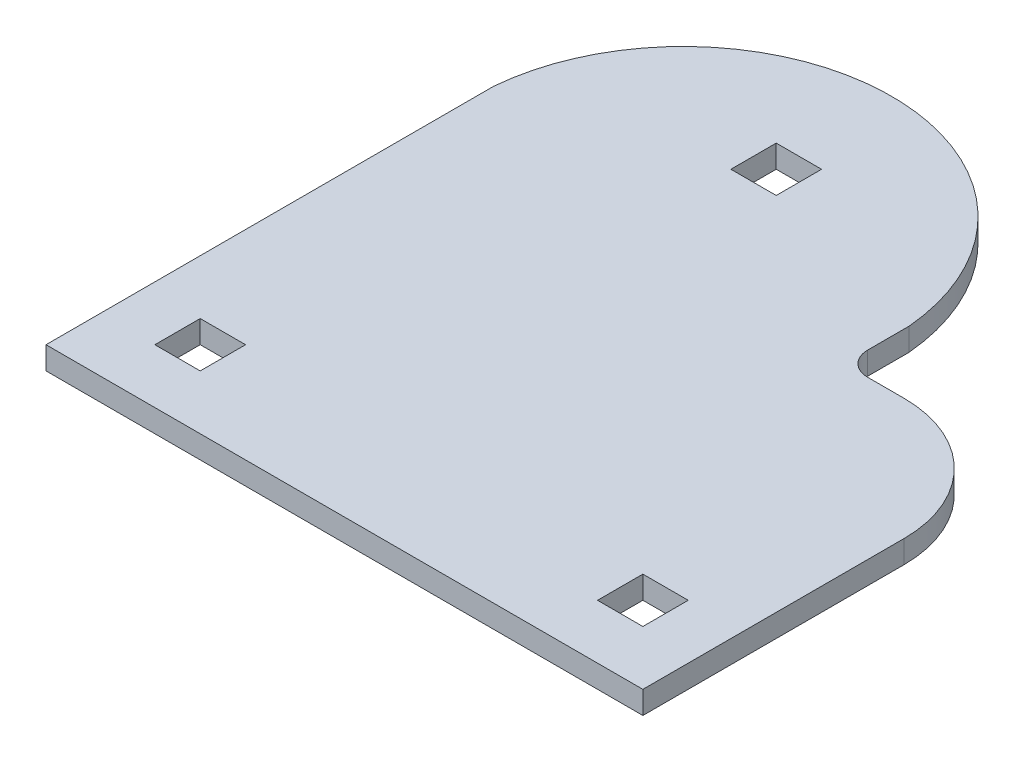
SolidWorks part; units mm, degrees
ref_plane "Front Plane" through (0, 0, 0) normal (0, 0, 1) x (1, 0, 0)
ref_plane "Top Plane" through (0, 0, 0) normal (0, 1, 0) x (1, 0, 0)
ref_plane "Right Plane" through (0, 0, 0) normal (1, 0, 0) x (0, 0, -1)
sketch "circuit outline" plane through (0, 0, 0) normal (0, 1, 0) x (1, 0, 0)
  line L0 (-69.85, 0) -> (-69.85, 15.875)
  line L1 (0, -31.75) -> (-69.85, -31.75)
  line L2 (0, -31.75) -> (0, 0)
  line L3 (0, 0) -> (-17.78, 0)
  line L4 (-69.85, -31.75) -> (-69.85, 0)
  line L5 (-25.4, 15.875) -> (-25.4, 7.62)
  arc A0 (-25.4, 15.875) -> (-69.85, 15.875) centre (-47.625, 15.875) ccw
  arc A1 (-17.78, 0) -> (-25.4, 7.62) centre (-17.78, 7.62) cw
  point P6 (-47.625, 38.1)
  dimension "D3" = 44.45
  dimension "D5" = 7.62
  dimension "D1" = 38.1
  dimension "D2" = 69.85
  dimension "D4" = 31.75
sketch "Sketch2" plane through (0, 0, 0) normal (0, 1, 0) x (1, 0, 0)
  line L0 (0, -31.75) -> (0, 0) construction
  line L1 (0, -31.75) -> (0, 0) construction
  line L2 (0, -31.75) -> (-69.85, -31.75) construction
  line L3 (-69.85, -31.75) -> (-69.85, 0) construction
  line L4 (-69.85, 0) -> (-69.85, 15.875) construction
  line L5 (-25.4, 15.875) -> (-25.4, 7.62) construction
  line L6 (0, 0) -> (-17.78, 0) construction
  line L7 (0, -31.75) -> (-69.85, -31.75) construction
  line L8 (-69.85, -31.75) -> (-69.85, 0) construction
  line L9 (-69.85, 0) -> (-69.85, 15.875) construction
  line L10 (-25.4, 15.875) -> (-25.4, 7.62) construction
  line L11 (0, 0) -> (-17.78, 0) construction
  line L12 (5.08, -36.83) -> (5.08, -10.16)
  line L13 (-10.16, 5.08) -> (-15.24, 5.08)
  line L14 (-20.32, 15.875) -> (-20.32, 10.16)
  line L15 (-74.93, 0) -> (-74.93, 15.875)
  line L16 (-74.93, -36.83) -> (-74.93, 0)
  line L17 (5.08, -36.83) -> (-74.93, -36.83)
  line L19 (-76.708, -38.608) -> (6.858, -38.608)
  line L20 (-76.708, -38.608) -> (-76.708, -44.9372)
  line L21 (-18.542, 15.9538) -> (-18.542, 10.16)
  line L22 (-76.708, 0) -> (-76.708, 15.9538)
  line L23 (-76.708, -38.608) -> (-76.708, 0)
  line L24 (6.858, -38.608) -> (-76.708, -38.608)
  line L25 (6.858, -38.608) -> (6.858, -10.16)
  line L26 (-10.16, 6.858) -> (-15.24, 6.858)
  line L27 (-22.098, 14.7785) -> (-22.098, 9.0635)
  line L28 (-73.152, -1.0965) -> (-73.152, 14.7785)
  line L29 (-73.152, -36.1485) -> (-73.152, -1.0965)
  line L30 (3.302, -36.1485) -> (-73.152, -36.1485)
  line L31 (3.302, -36.1485) -> (3.302, -11.2565)
  line L32 (-10.16, 2.2055) -> (-15.24, 2.2055)
  line L33 (-76.708, -44.9372) -> (6.858, -44.9372)
  line L34 (6.858, -38.608) -> (6.858, -44.9372)
  line L35 (-76.708, -44.9372) -> (6.858, -44.9372)
  line L36 (-76.708, -44.9372) -> (-76.708, -46.7152)
  line L37 (-76.708, -46.7152) -> (6.858, -46.7152)
  line L38 (6.858, -44.9372) -> (6.858, -46.7152)
  arc A0 (-25.4, 15.875) -> (-69.85, 15.875) centre (-47.625, 15.875) ccw construction
  arc A1 (-25.4, 7.62) -> (-17.78, 0) centre (-17.78, 7.62) ccw construction
  arc A2 (-25.4, 15.875) -> (-69.85, 15.875) centre (-47.625, 15.875) ccw construction
  arc A3 (-25.4, 7.62) -> (-17.78, 0) centre (-17.78, 7.62) ccw construction
  arc A5 (-20.32, 15.875) -> (-74.93, 15.875) centre (-47.625, 13.4126) ccw
  arc A6 (5.08, -10.16) -> (-10.16, 5.08) centre (-10.16, -10.16) ccw
  arc A8 (-15.24, 5.08) -> (-20.32, 10.16) centre (-15.24, 10.16) cw
  arc A9 (-15.24, 6.858) -> (-18.542, 10.16) centre (-15.24, 10.16) cw
  arc A10 (-18.542, 15.9538) -> (-76.708, 15.9538) centre (-47.625, 13.4126) ccw
  arc A11 (6.858, -10.16) -> (-10.16, 6.858) centre (-10.16, -10.16) ccw
  arc A12 (-15.24, 2.2055) -> (-22.098, 9.0635) centre (-15.24, 9.0635) cw
  arc A13 (-22.098, 14.7785) -> (-73.152, 14.7785) centre (-47.625, 13.335) ccw
  arc A14 (3.302, -11.2565) -> (-10.16, 2.2055) centre (-10.16, -11.2565) ccw
  dimension "D2" = 15.24
  dimension "D3" = 5.08
  dimension "D1" = 6.3292
  dimension "D5" = 2.54
  dimension "D6" = 1.778
  dimension "D4" = 1.778
extrude "lid" add sketch "Sketch2" along normal blind 3.175 contours L34 L19 L20 L33 | L38 L33 L36 L37 | L22 A10 L21 A9 L26 A11 L25 L24 L23
sketch "Sketch3" plane through (0, 3.175, 0) normal (0, 1, 0) x (1, 0, 0)
  line L0 (-34.925, -46.7152) -> (-34.925, -57.3007) construction
  line L1 (-76.708, -46.7152) -> (6.858, -46.7152) construction
  line L2 (-76.708, 15.9538) -> (-76.708, -46.7152) construction
  line L3 (-69.088, -39.0952) -> (-62.738, -39.0952)
  line L4 (-69.088, -39.0952) -> (-69.088, -32.7452)
  line L5 (-69.088, -32.7452) -> (-62.738, -32.7452)
  line L6 (-62.738, -39.0952) -> (-62.738, -32.7452)
  line L7 (-69.088, -39.0952) -> (-62.738, -32.7452) construction
  line L8 (-69.088, -32.7452) -> (-62.738, -39.0952) construction
  line L9 (-0.762, -32.7452) -> (-7.112, -39.0952) construction
  line L10 (-0.762, -39.0952) -> (-7.112, -32.7452) construction
  line L11 (-7.112, -39.0952) -> (-7.112, -32.7452)
  line L12 (-0.762, -32.7452) -> (-7.112, -32.7452)
  line L13 (-0.762, -39.0952) -> (-0.762, -32.7452)
  line L14 (-0.762, -39.0952) -> (-7.112, -39.0952)
  line L16 (-50.038, 28.8498) -> (-43.688, 28.8498)
  line L17 (-50.038, 28.8498) -> (-50.038, 22.4998)
  line L18 (-50.038, 22.4998) -> (-43.688, 22.4998)
  line L19 (-43.688, 28.8498) -> (-43.688, 22.4998)
  line L20 (-50.038, 28.8498) -> (-43.688, 22.4998) construction
  line L21 (-50.038, 22.4998) -> (-43.688, 28.8498) construction
  point P4 (-65.913, -35.9202)
  point P15 (-3.937, -35.9202)
  point P16 (-46.863, 25.6748)
  dimension "D1" = 6.35
  dimension "D2" = 7.62
  dimension "D3" = 7.62
  dimension "D4" = 58.42
  dimension "D5" = 12.7
extrude "Cut-Extrude1" cut sketch "Sketch3" against normal through all and the other way through all
